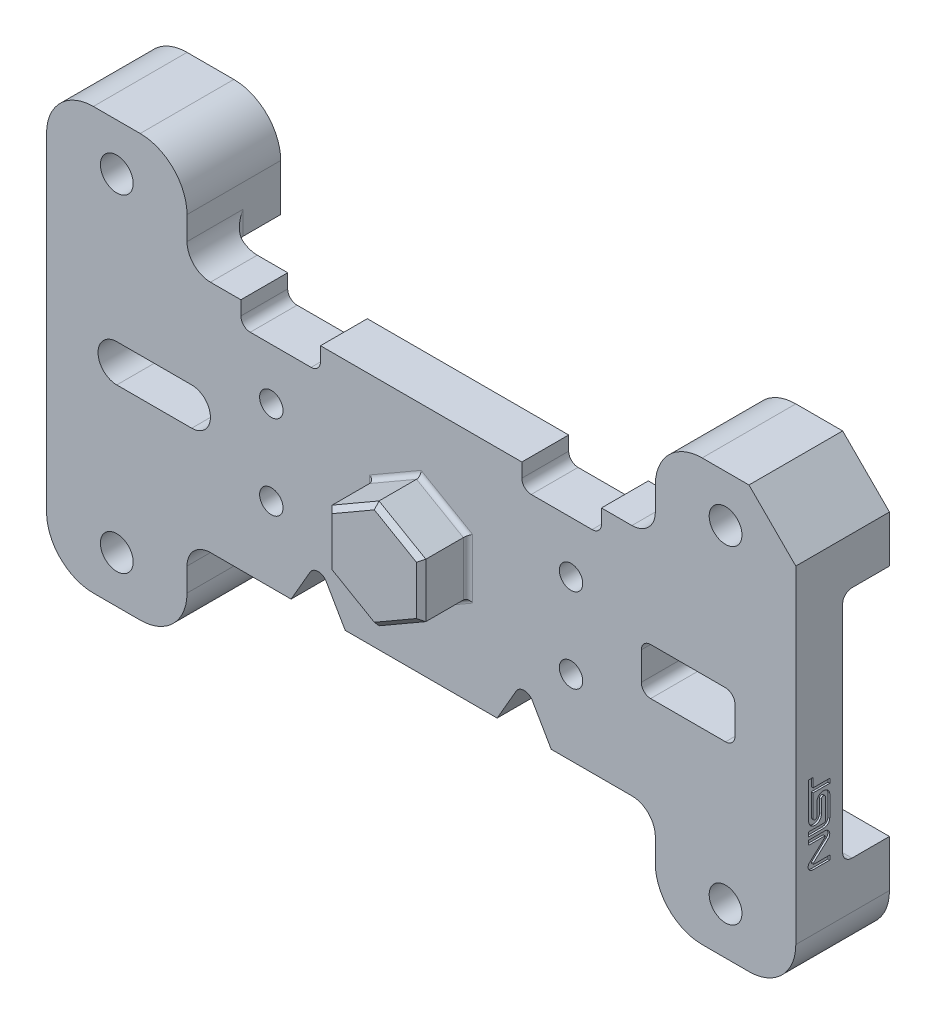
SolidWorks part; units mm, degrees
other "DetailItem8"
other "DetailItem9"
ref_plane "Front Plane" through (0, 0, 0) normal (0, 0, 1) x (1, 0, 0)
ref_plane "Top Plane" through (0, 0, 0) normal (0, 1, 0) x (1, 0, 0)
ref_plane "Right Plane" through (0, 0, 0) normal (1, 0, 0) x (0, 0, -1)
sketch "Sketch1" plane through (0, 0, 0) normal (0, 0, 1) x (1, 0, 0)
  line L0 (300, -225) -> (350, -225)
  line L1 (-350, 225) -> (-300, 225)
  line L2 (-400, 175) -> (-400, -175)
  line L3 (-350, -225) -> (-300, -225)
  line L4 (400, 175) -> (400, -175)
  line L5 (-107.5, 125) -> (107.5, 125)
  line L6 (-250, 175) -> (-250, 150)
  line L7 (-225, 125) -> (-192.5, 125)
  line L8 (250, 175) -> (250, 150)
  line L9 (-225, -125) -> (-138.8675, -125)
  line L10 (-250, -150) -> (-250, -175)
  line L11 (192.5, 125) -> (225, 125)
  line L12 (250, -150) -> (250, -175)
  line L13 (300, 225) -> (350, 225)
  line L14 (-192.5, 125) -> (-192.5, 110)
  line L15 (-182.5, 100) -> (-117.5, 100)
  line L16 (-107.5, 125) -> (-107.5, 110)
  line L17 (0, 0) -> (0, -212.3654) construction
  line L18 (107.5, 125) -> (107.5, 110)
  line L19 (117.5, 100) -> (182.5, 100)
  line L20 (192.5, 125) -> (192.5, 110)
  line L21 (-138.8675, -125) -> (-118.6603, -90)
  line L22 (-101.3397, -90) -> (-81.1325, -125)
  line L23 (-81.1325, -125) -> (81.1325, -125)
  line L24 (81.1325, -125) -> (101.3397, -90)
  line L25 (118.6603, -90) -> (138.8675, -125)
  line L26 (138.8675, -125) -> (225, -125)
  line L27 (350, 225) -> (400, 175)
  line L28 (245, 25) -> (325, 25)
  line L29 (235, 15) -> (235, -15)
  line L30 (245, -25) -> (325, -25)
  line L31 (335, 15) -> (335, -15)
  line L32 (-325, 20) -> (-245, 20)
  line L34 (-325, -20) -> (-245, -20)
  arc A0 (250, 175) -> (300, 225) centre (300, 175) cw
  arc A2 (400, -175) -> (350, -225) centre (350, -175) cw
  arc A3 (300, -225) -> (250, -175) centre (300, -175) cw
  arc A4 (-250, -175) -> (-300, -225) centre (-300, -175) cw
  arc A5 (-350, -225) -> (-400, -175) centre (-350, -175) cw
  arc A6 (-400, 175) -> (-350, 225) centre (-350, 175) cw
  arc A7 (-250, 175) -> (-300, 225) centre (-300, 175) ccw
  arc A8 (-250, -150) -> (-225, -125) centre (-225, -150) cw
  arc A9 (225, -125) -> (250, -150) centre (225, -150) cw
  arc A10 (250, 150) -> (225, 125) centre (225, 150) cw
  arc A11 (-225, 125) -> (-250, 150) centre (-225, 150) cw
  arc A12 (192.5, 110) -> (182.5, 100) centre (182.5, 110) cw
  arc A13 (117.5, 100) -> (107.5, 110) centre (117.5, 110) cw
  arc A14 (-107.5, 110) -> (-117.5, 100) centre (-117.5, 110) cw
  arc A15 (-182.5, 100) -> (-192.5, 110) centre (-182.5, 110) cw
  arc A16 (118.6603, -90) -> (101.3397, -90) centre (110, -95) ccw
  arc A17 (-101.3397, -90) -> (-118.6603, -90) centre (-110, -95) ccw
  arc A18 (325, 25) -> (335, 15) centre (325, 15) cw
  arc A19 (335, -15) -> (325, -25) centre (325, -15) cw
  arc A20 (245, -25) -> (235, -15) centre (245, -15) cw
  arc A21 (235, 15) -> (245, 25) centre (245, 15) cw
  arc A22 (-245, -20) -> (-245, 20) centre (-245, 0) ccw
  arc A23 (-325, -20) -> (-325, 20) centre (-325, 0) cw
  dimension "D8" = 50
  dimension "D13" = 50
  dimension "D19" = 25
  dimension "D20" = 25
  dimension "D21" = 25
  dimension "D22" = 25
  dimension "D24" = 107.5
  dimension "D25" = 107.5
  dimension "D26" = 85
  dimension "D27" = 10
  dimension "D33" = 10
  dimension "D34" = 10
  dimension "D43" = 10
  dimension "D44" = 10
  dimension "D45" = 10
  dimension "D46" = 10
  dimension "D47" = 80
  dimension "D1" = 400
  dimension "D2" = 800
  dimension "D3" = 225
  dimension "D4" = 450
  dimension "D5" = 100
  dimension "D6" = 100
  dimension "D15" = 500
  dimension "D16" = 150
  dimension "D17" = 500
  dimension "D18" = 150
  dimension "D23" = 25
  dimension "D28" = 85
  dimension "D29" = 30
  dimension "D30" = 30
  dimension "D31" = 60
  dimension "D32" = 60
  dimension "D35" = 110
  dimension "D36" = 110
  dimension "D37" = 30
  dimension "D38" = 30
  dimension "D39" = 235
  dimension "D40" = 100
  dimension "D41" = 25
  dimension "D42" = 50
  dimension "D48" = 40
  dimension "D49" = 245
  dimension "D50" = 0
  dimension "D51" = 45
extrude "Boss-Extrude1" add sketch "Sketch1" against normal blind 100
sketch "Sketch2" plane through (0, 0, 0) normal (0, 0, 1) x (1, 0, 0)
  line L1 (0, 57.735) -> (-50, 28.8675)
  line L2 (-50, 28.8675) -> (-50, -28.8675)
  line L3 (-50, -28.8675) -> (0, -57.735)
  line L4 (0, -57.735) -> (50, -28.8675)
  line L5 (50, -28.8675) -> (50, 28.8675)
  line L6 (50, 28.8675) -> (0, 57.735)
  circle A0 centre (0, 0) radius 50 construction
extrude "Boss-Extrude2" add sketch "Sketch2" along normal blind 50
sketch "Sketch3" plane through (0, 0, -100) normal (0, 0, -1) x (-1, 0, 0)
  line L0 (-250, -125) -> (-250, -285.8393)
  line L1 (-250, 257.3417) -> (250, 257.3417)
  line L2 (-250, 257.3417) -> (-250, 125)
  line L3 (-250, -285.8393) -> (250, -285.8393)
  line L4 (250, 257.3417) -> (250, 125)
  line L5 (-508.6386, 125) -> (-250, 125)
  line L6 (-508.6386, 125) -> (-508.6386, -125)
  line L7 (-508.6386, -125) -> (-250, -125)
  line L8 (518.1377, 125) -> (518.1377, -125)
  line L9 (250, -125) -> (250, -285.8393)
  line L10 (250, -125) -> (518.1377, -125)
  line L11 (250, 125) -> (518.1377, 125)
  dimension "D1" = 500
  dimension "D2" = 250
  dimension "D3" = 125
  dimension "D4" = 250
extrude "Cut-Extrude1" cut sketch "Sketch3" against normal blind 50
fillet "Fillet1" radius 10 8 edges at (325, -125, -50) (250, -137.5, -50) (-250, -137.5, -50) (-325, -125, -50) (-250, 137.5, -50) (-325, 125, -50) (250, 137.5, -50) (325, 125, -50)
hole_wizard "Ø20mm Diameter Hole1" positions "Sketch5" profile "Sketch4" hole size "Ø20.0" standard "ISO"
sketch "Sketch5" plane through (0, -125, 0) normal (0, -1, 0) x (-1, 0, 0)
  line L0 (81.1325, 0) -> (-81.1325, 0) construction
  point P0 (30, 25)
  point P2 (-30, 25)
  point P7 (0, 0)
  dimension "D1" = 25
  dimension "D2" = 25
  dimension "D3" = 60
  dimension "D4" = 30
sketch "Sketch4" plane through (-30, -125, -25) normal (1, 0, 0) x (0, 0, -1)
  line L0 (0, 0) -> (0, 51.0086)
  line L1 (0, 51.0086) -> (10, 45)
  line L2 (10, 45) -> (10, 0)
  line L5 (10, 0) -> (0, 0)
  line L10 (0, 51.0086) -> (-10, 45) construction
  line L11 (0, -6.35) -> (0, 107.95) construction
  dimension "Hole Dia." = 20
  dimension "Hole Depth" = 45
  dimension "Drill Angle" = 118
hole_wizard "Ø35mm Diameter Hole1" positions "Sketch7" profile "Sketch6" hole size "Ø0.35" standard "ANSI Metric"
sketch "Sketch7" plane through (0, 0, 0) normal (0, 0, 1) x (1, 0, 0)
  point P0 (-325, -175)
  point P2 (-325, 175)
  point P4 (325, 175)
  point P6 (325, -175)
  dimension "D1" = 650
  dimension "D2" = 650
  dimension "D3" = 350
  dimension "D4" = 325
  dimension "D5" = 175
  dimension "D6" = 325
  dimension "D7" = 175
  dimension "D8" = 350
sketch "Sketch6" plane through (-325, -175, 0) normal (1, 0, 0) x (0, -1, 0)
  line L0 (0, 0) -> (0, 100)
  line L1 (0, 100) -> (17.5, 100)
  line L2 (17.5, 100) -> (17.5, 0)
  line L5 (17.5, 0) -> (0, 0)
  line L11 (0, -6.35) -> (0, 107.95) construction
  dimension "Thru Hole Dia." = 35
  dimension "Thru Hole Depth" = 100
hole_wizard "Ø25mm Diameter Hole2" positions "Sketch9" profile "Sketch8" hole size "Ø0.35" standard "ANSI Metric"
sketch "Sketch9" plane through (0, 0, 0) normal (0, 0, 1) x (1, 0, 0)
  point P0 (-160, 45)
  point P2 (-160, -45)
  point P4 (160, -45)
  point P6 (160, 45)
  dimension "D1" = 160
  dimension "D2" = 45
  dimension "D3" = 90
  dimension "D4" = 320
  dimension "D5" = 160
  dimension "D6" = 320
  dimension "D7" = 45
  dimension "D8" = 90
sketch "Sketch8" plane through (-160, 45, 0) normal (1, 0, 0) x (0, -1, 0)
  line L0 (0, 0) -> (0, 100)
  line L1 (0, 100) -> (12.5, 100)
  line L2 (12.5, 100) -> (12.5, 0)
  line L5 (12.5, 0) -> (0, 0)
  line L11 (0, -6.35) -> (0, 107.95) construction
  dimension "Thru Hole Dia." = 25
  dimension "Thru Hole Depth" = 100
fillet "Fillet2" radius 5 6 edges at (-25, -43.3013, 0) (-50, 0, 0) (-25, 43.3013, 0) (25, 43.3013, 0) (50, 0, 0) (25, -43.3013, 0)
chamfer "Chamfer1" distance 5 angle 45 6 edges at (50, 0, 50) (25, -43.3013, 50) (-25, -43.3013, 50) (-50, 0, 50) (-25, 43.3013, 50) (25, 43.3013, 50)
ref_point "Point1"
sketch "Sketch13" plane through (400, 0, 0) normal (1, 0, 0) x (0, 0, -1)
  line L0 (13.75, -82.3284) -> (29.9564, -82.3284)
  line L1 (36.25, -76.0347) -> (36.25, -53.234)
  line L2 (22.7156, -53.234) -> (22.7156, -67.6742)
  line L3 (18.4915, -67.5017) -> (18.4915, -43.9666)
  line L4 (18.4915, -43.9666) -> (36.25, -43.9666)
  line L5 (36.25, -43.9666) -> (36.25, -39.3128)
  line L6 (36.25, -39.3128) -> (18.4915, -39.3128)
  line L7 (18.4915, -39.3128) -> (18.4915, -29.6989)
  line L8 (18.4915, -29.6989) -> (13.75, -29.6989)
  line L9 (13.75, -29.6989) -> (13.75, -68.1038)
  line L10 (27.3706, -67.5879) -> (27.3706, -54.0102)
  line L11 (31.5952, -53.9239) -> (31.5952, -75.9911)
  line L12 (29.9564, -77.63) -> (13.75, -77.63)
  line L13 (13.75, -77.63) -> (13.75, -82.3284)
  line L14 (36.25, -115) -> (18.0069, -115)
  line L15 (14.6859, -106.5172) -> (31.3365, -91.1199)
  line L16 (30.8622, -90.0435) -> (13.75, -90.0435)
  line L17 (13.75, -90.0435) -> (13.75, -85.3451)
  line L18 (13.75, -85.3451) -> (30.9743, -85.3451)
  line L19 (34.2709, -94.7398) -> (18.8365, -108.9405)
  line L20 (19.3848, -110.3463) -> (36.25, -110.3463)
  line L21 (36.25, -110.3463) -> (36.25, -115)
  arc A0 (29.9564, -82.3284) -> (36.25, -76.0347) centre (29.9564, -76.0347) ccw
  arc A1 (36.25, -53.234) -> (22.7156, -53.234) centre (29.4828, -54.3117) ccw
  arc A2 (18.4915, -67.5017) -> (22.7156, -67.6742) centre (20.6, -67.6742) ccw
  arc A3 (13.75, -68.1038) -> (27.3706, -67.5879) centre (20.5701, -68.1038) ccw
  arc A4 (31.5952, -53.9239) -> (27.3706, -54.0102) centre (29.4876, -54.1942) ccw
  arc A5 (14.6859, -106.5172) -> (18.0069, -115) centre (18.0069, -110.1085) ccw
  arc A6 (31.3365, -91.1199) -> (30.8622, -90.0435) centre (30.9143, -90.6633) ccw
  arc A7 (18.8365, -108.9405) -> (19.3848, -110.3463) centre (19.3848, -109.5365) ccw
  arc A8 (29.9564, -77.63) -> (31.5952, -75.9911) centre (29.9564, -75.9911) ccw
  arc A9 (34.2709, -94.7398) -> (30.9743, -85.3451) centre (30.9743, -90.6208) ccw
extrude "Cut-Extrude2" cut sketch "Sketch13" against normal blind 2
